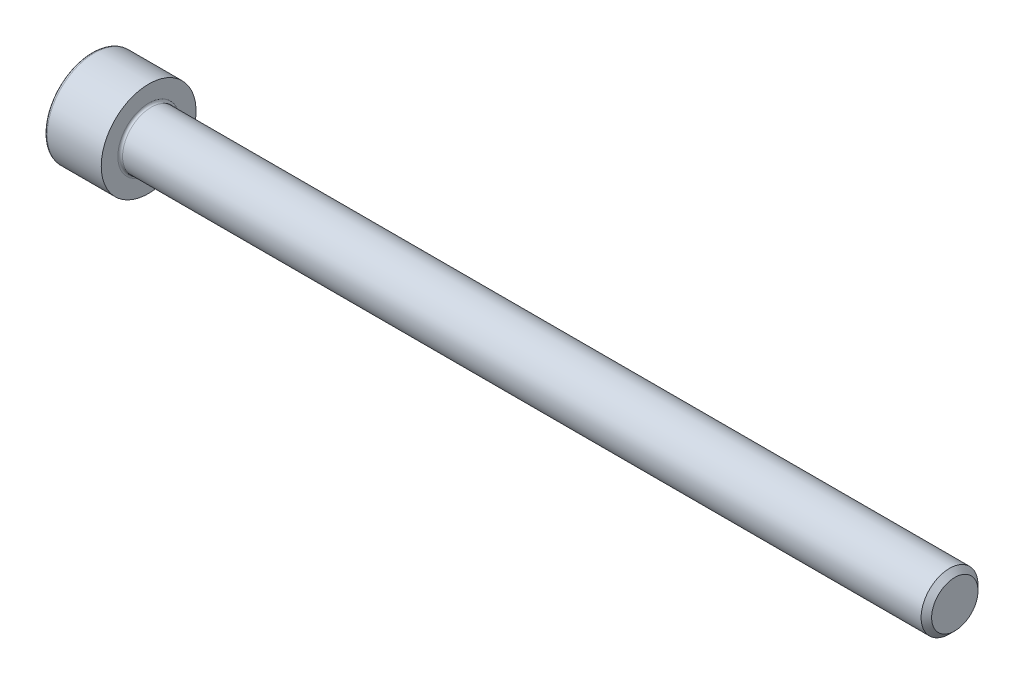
SolidWorks part; units mm, degrees
ref_plane "Plane1" through (0, 0, 0) normal (0, 0, 1) x (1, 0, 0)
ref_plane "Plane2" through (0, 0, 0) normal (0, 1, 0) x (1, 0, 0)
ref_plane "Plane3" through (0, 0, 0) normal (1, 0, 0) x (0, 0, -1)
sketch "BodySke" plane through (0, 0, 0) normal (0, 0, 1) x (1, 0, 0)
  line L0 (0, 0) -> (0, 5)
  line L1 (0, 5) -> (6, 5)
  line L2 (6, 5) -> (6, 3)
  line L3 (6, 3) -> (90.4455, 3)
  line L4 (91, 2.4455) -> (91, 0)
  line L5 (91, 0) -> (0, 0)
  line L6 (-31.75, 0) -> (127, 0) construction
  line L8 (91, 2.4455) -> (90.4455, 3)
  line L10 (91, -2.4455) -> (90.4455, -3) construction
  line L11 (7, 9.525) -> (7, 3.175) construction
  line L12 (67, 9.525) -> (67, 3.175) construction
  line L13 (31, 9.525) -> (31, 3.175) construction
  dimension "Diameter" = 6
  dimension "Head_ht" = 6
  dimension "Length" = 85
  dimension "Body_ch_ang" = 45
  dimension "Head_dia" = 10
  dimension "Minor_dia" = 4.891
  dimension "Advance" = 1
  dimension "Thread_nom" = 24
  dimension "Thread_length" = 60
revolve "Base-Revolve" add sketch "BodySke"
fillet "Fillet1" radius 0.25 1 edges at (6, 0, 3)
fillet "Fillet2" radius 0.3 1 edges at (0, 0, 5)
sketch "Sketch2" plane through (0, 0, 0) normal (0, 0, 1) x (1, 0, 0)
  line L0 (0, 2.542) -> (3, 2.542)
  line L1 (3, 2.542) -> (4.4676, 0)
  line L2 (-31.75, 0) -> (127, 0) construction
  line L3 (4.4676, 0) -> (0, 0)
  line L4 (0, 0) -> (0, 2.542)
  line L6 (0, 0) -> (47.625, 0) construction
  dimension "D1" = 2.542
  dimension "D2" = 60
  dimension "Depth" = 3
revolve "Hex-PreBroach" cut sketch "Sketch2" angle 360 about L6
sketch "Sketch3" plane through (0, 0, 0) normal (-1, 0, 0) x (0, 0.5, 0.866)
  line L0 (1.4676, 2.542) -> (-1.4676, 2.542)
  line L1 (-1.4676, 2.542) -> (-2.9352, 0)
  line L2 (1.4676, 2.542) -> (2.9352, 0)
  line L3 (1.4676, -2.542) -> (2.9352, 0)
  line L4 (1.4676, -2.542) -> (-1.4676, -2.542)
  line L5 (-1.4676, -2.542) -> (-2.9352, 0)
  dimension "D1" = 2.542
  dimension "D2" = 2.542
  dimension "Hex_size" = 5.084
extrude "Hex" cut sketch "Sketch3" against normal blind 3
sketch "ThdSchSke" plane through (0, 0, 0) normal (0, 0, 1) x (1, 0, 0)
  line L0 (67, -2.4455) -> (66.6117, -3)
  line L1 (67, -2.4455) -> (67.3883, -3)
  line L2 (67.3883, -3) -> (67.3883, -3.75)
  line L3 (-3.175, 0) -> (5.1513, 0) construction
  line L4 (0, 4.7) -> (0, -4.7) construction
  line L5 (67.3883, -3.75) -> (66.6117, -3.75)
  line L6 (66.6117, -3.75) -> (66.6117, -3)
  dimension "Thread_minor" = 4.891
  dimension "Diameter" = 6
  dimension "Start" = 67
  dimension "SideAngle" = 55
  dimension "VeeAngle" = 70
  dimension "Overcut" = 7.5
revolve "ThreadSchematic" [suppressed] cut sketch "ThdSchSke" angle 360 about L3
pattern_linear "ThdSchPat" [suppressed]
equation "\"D2@Sketch3\" = \"Hex_size@Sketch3\" / 2"
equation "\"D1@Sketch3\" = \"Hex_size@Sketch3\" / 2"
equation "\"D1@Sketch2\" = \"Hex_size@Sketch3\" / 2"
equation "\"Thread_minor@ThreadCosmetic\"  =  \"Minor_dia@BodySke\""
equation "\"Depth@Sketch2\" =  \"Key_eng@Hex\""
equation "\"Thread_length@ThreadCosmetic\" = ((sgn( (\"Length@BodySke\" - \"Advance@BodySke\" * 3.0) - \"Thread_nom@BodySke\" )-1)*( (\"Length@BodySke\" - \"Advance@BodySke\" * 3.0) - \"Thread_nom@BodySke\" ))/-2+ \"Thread_no"
equation "\"Thread_minor@ThdSchSke\" = \"Minor_dia@BodySke\""
equation "\"Diameter@ThdSchSke\" = \"Diameter@BodySke\""
equation "\"Overcut@ThdSchSke\" = \"Diameter@BodySke\" * 1.25"
equation "\"Start@ThdSchSke\" = \"Head_ht@BodySke\" + \"Length@BodySke\" - \"Thread_length@ThreadCosmetic\"  '---Non-countersunk---"
equation "\"Num_threads@ThdSchPat\" = int( \"Thread_length@ThreadCosmetic\" / \"Advance@BodySke\" + 0.999 )  + 1"
equation "\"Advance@ThdSchPat\" = \"Thread_length@ThreadCosmetic\" /  (\"Num_threads@ThdSchPat\" - 1) 'relax it"
equation "\"Num_threads@ThdSchPat\" = \"Num_threads@ThdSchPat\" - sgn( \"Num_threads@ThdSchPat\" - 1) '---chamfered tips only---"
